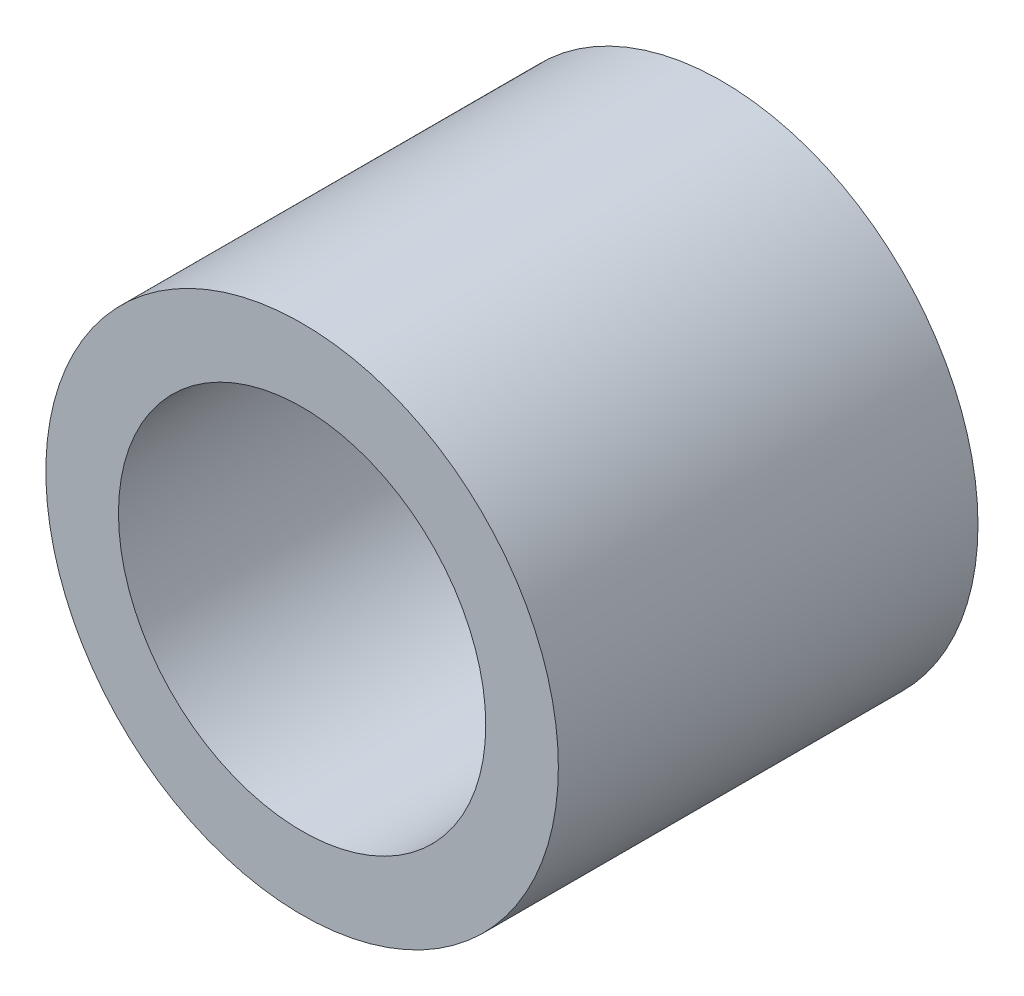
SolidWorks part; units mm, degrees
ref_plane "Plan de face" through (0, 0, 0) normal (0, 0, 1) x (1, 0, 0)
ref_plane "Plan de dessus" through (0, 0, 0) normal (0, 1, 0) x (1, 0, 0)
ref_plane "Plan de droite" through (0, 0, 0) normal (1, 0, 0) x (0, 0, -1)
sketch "Esquisse1" plane through (0, 0, 0) normal (0, 0, 1) x (1, 0, 0)
  circle A0 centre (0, 0) radius 8.6
  circle A1 centre (0, 0) radius 12
  dimension "D1" = 24
  dimension "D2" = 17.2
extrude "Extrusion1" add sketch "Esquisse1" along normal blind 19.65
